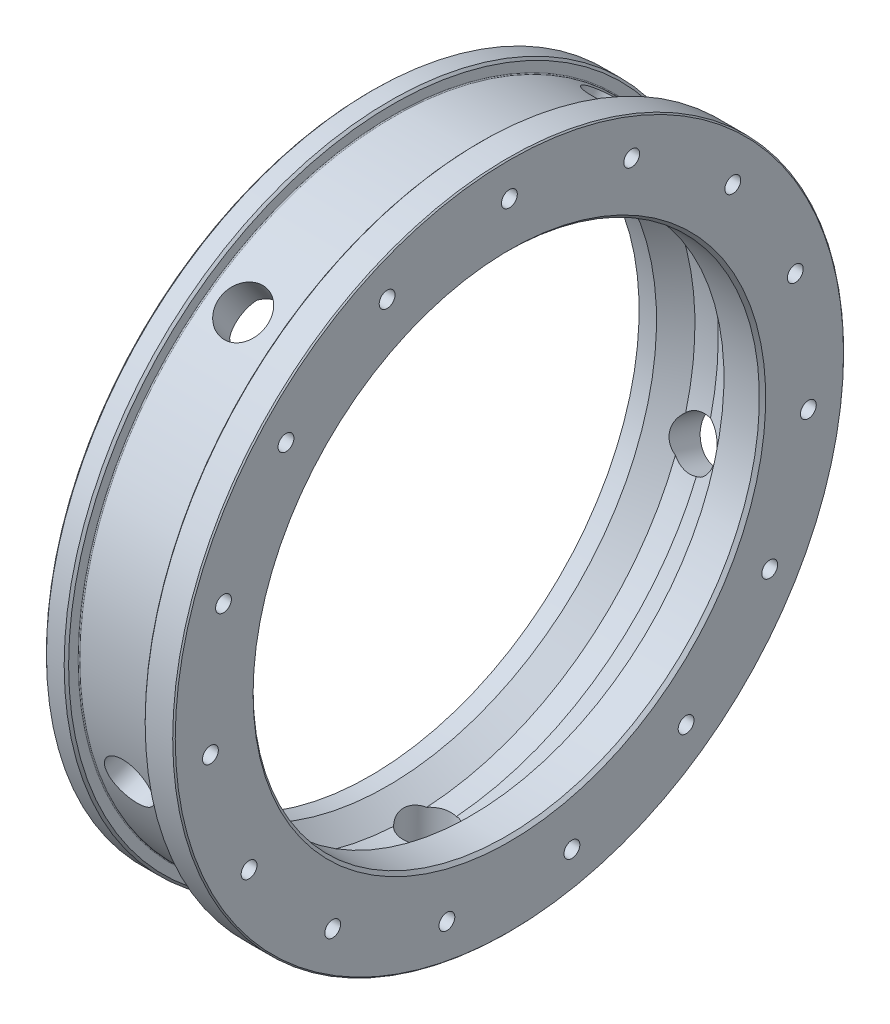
SolidWorks part; units mm, degrees
ref_plane "Front" through (0, 0, 0) normal (0, 0, 1) x (1, 0, 0)
ref_plane "Top" through (0, 0, 0) normal (0, 1, 0) x (1, 0, 0)
ref_plane "Right" through (0, 0, 0) normal (1, 0, 0) x (0, 0, -1)
sketch "Sketch1" plane through (0, 0, 0) normal (0, 0, 1) x (1, 0, 0)
  line L0 (0, 0) -> (23.2912, 0) construction
  line L1 (0, 103) -> (0, 85)
  line L2 (0, 85) -> (5.5, 85)
  line L3 (5.5, 85) -> (12.6407, 90)
  line L4 (12.6407, 90) -> (20, 90)
  line L5 (20, 90) -> (31.8, 85.7052)
  line L6 (31.8, 85.7052) -> (31.8, 80)
  line L7 (31.8, 80) -> (44, 80)
  line L8 (44, 80) -> (44, 106)
  line L9 (44, 106) -> (34.5, 106)
  line L10 (34.5, 106) -> (34.5, 99)
  line L11 (34.5, 99) -> (7, 99)
  line L12 (7, 99) -> (7, 103)
  line L13 (7, 103) -> (0, 103)
  dimension "D1" = 206
  dimension "D2" = 170
  dimension "D3" = 180
  dimension "D4" = 160
  dimension "D5" = 212
  dimension "D6" = 198
  dimension "D7" = 44
  dimension "D8" = 7
  dimension "D9" = 9.5
  dimension "D10" = 5.5
  dimension "D11" = 31.8
  dimension "D12" = 35
  dimension "D13" = 20
  dimension "D14" = 20
revolve "Revolve1" add sketch "Sketch1" angle 360 about L0
hole_wizard "M6 Tapped Hole1" positions "Sketch2" profile "Sketch3" tap size "M6" standard "ISO"
sketch "Sketch2" plane through (44, 0, 0) normal (1, 0, 0) x (0, 0, -1)
  circle A0 centre (0, 0) radius 95 construction
  point P2 (0, 95)
  point P13 (0, 140.5244)
  point P14 (0, 0)
  point P15 (-137.4203, 4.6799)
  point P16 (0, 0)
  point P17 (-6.6657, 137.3383)
  dimension "D1" = 190
sketch "Sketch3" plane through (44, 95, 0) normal (0, 1, 0) x (0, 0, -1)
  line L0 (0, 0) -> (0, 13.5022)
  line L1 (0, 13.5022) -> (2.5, 12)
  line L2 (2.5, 12) -> (2.5, 0)
  line L5 (2.5, 0) -> (0, 0)
  line L10 (0, 13.5022) -> (-2.5, 12) construction
  line L11 (0, -6.35) -> (0, 107.95) construction
  dimension "Tap Drill Dia." = 5
  dimension "Tap Drill Depth" = 12
  dimension "Drill Angle" = 118
pattern_circular "CirPattern1" count 15 over 360 about axis through (0, 0, 0) along (1, 0, 0) of "M6 Tapped Hole1"
chamfer "Chamfer1" distance 0.7 angle 45 2 edges at (7, 0, 103) (0, 0, 103)
chamfer "Chamfer2" distance 0.4 angle 45 2 edges at (44, 0, 106) (34.5, 0, 106)
fillet "Fillet1" radius 0.3 2 edges at (34.5, 0, 99) (7, 0, 99)
chamfer "Chamfer3" distance 1 angle 45 1 edges at (44, 0, 80)
sketch "Sketch5" plane through (0, 0, 0) normal (0, 1, 0) x (1, 0, 0)
  circle A0 centre (18, 0) radius 7.5
  point P2 (0, 0)
  point P4 (0, 0)
  dimension "D1" = 15
  dimension "D2" = 18
extrude "Cut-Extrude1" cut sketch "Sketch5" against normal through all
pattern_circular "CirPattern2" count 5 over 360 about axis through (44, 0, 0) along (-1, 0, 0) of "Cut-Extrude1"
